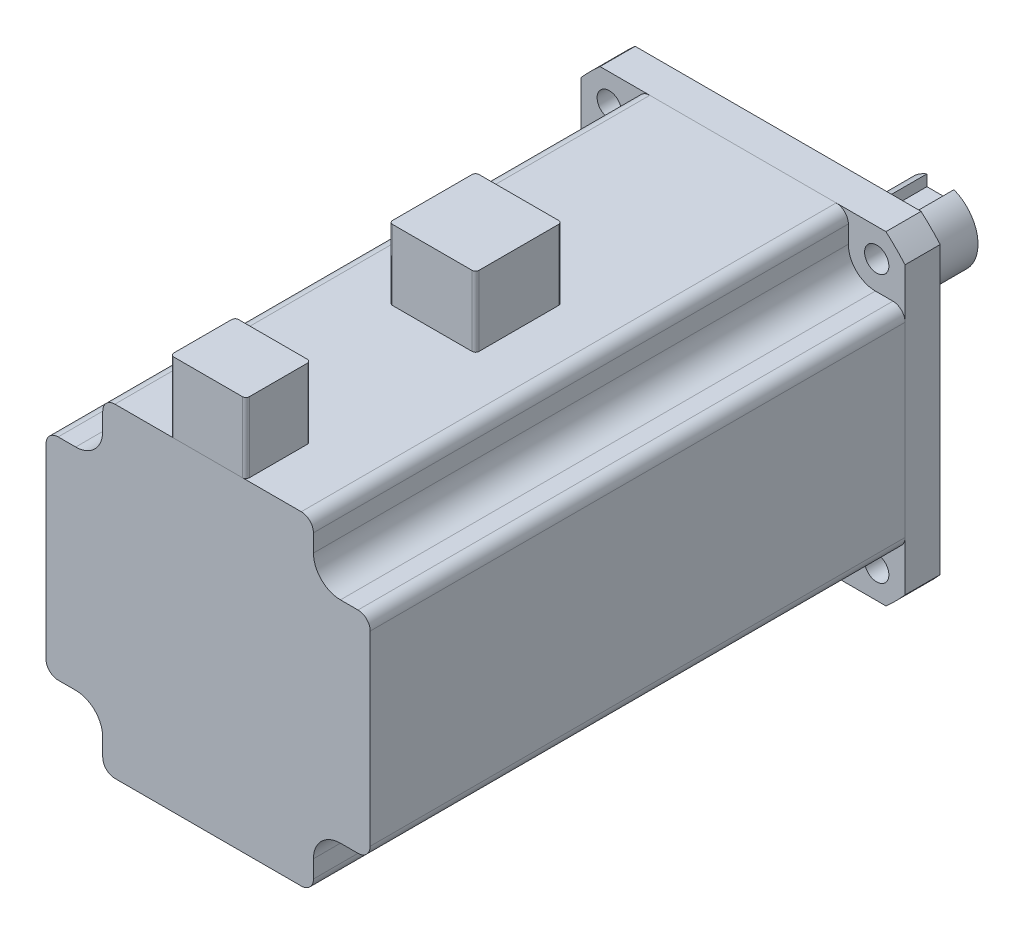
SolidWorks part; units mm, degrees
ref_plane "前视基准面" through (0, 0, 0) normal (0, 0, 1) x (1, 0, 0)
ref_plane "上视基准面" through (0, 0, 0) normal (0, 1, 0) x (1, 0, 0)
ref_plane "右视基准面" through (0, 0, 0) normal (1, 0, 0) x (0, 0, -1)
sketch "草图1" plane through (0, 0, 0) normal (0, 0, 1) x (1, 0, 0)
  line L1 (-59.0644, 2.8149) -> (-111.9794, 2.8149)
  line L2 (-55.5219, -0.7276) -> (-55.5219, -53.6426)
  line L3 (-59.0644, -57.1851) -> (-111.9794, -57.1851)
  line L4 (-115.5219, -0.7276) -> (-115.5219, -53.6426)
  line L5 (-57.2376, 1.0991) -> (-113.8062, -55.4694) construction
  line L6 (-57.2376, -55.4694) -> (-113.8062, 1.0991) construction
  circle A0 centre (-110.2706, -2.4364) radius 2.25
  circle A1 centre (-60.7732, -2.4364) radius 2.25
  circle A2 centre (-60.7732, -51.9339) radius 2.25
  circle A3 centre (-110.2706, -51.9339) radius 2.25
  arc A4 (-115.5219, -53.6426) -> (-111.9794, -57.1851) centre (-85.5219, -27.1851) ccw
  arc A5 (-111.9794, 2.8149) -> (-115.5219, -0.7276) centre (-85.5219, -27.1851) ccw
  arc A6 (-55.5219, -0.7276) -> (-59.0644, 2.8149) centre (-85.5219, -27.1851) ccw
  arc A7 (-59.0644, -57.1851) -> (-55.5219, -53.6426) centre (-85.5219, -27.1851) ccw
  point P0 (-85.5219, -27.1851)
  dimension "D3" = 4.5
  dimension "D4" = 35
  dimension "D6" = 80
  dimension "D5" = 4
extrude "凸台-拉伸1" add sketch "草图1" along normal blind 6.5
sketch "草图2" plane through (0, 0, 0) normal (0, 0, -1) x (-1, 0, 0)
  circle A0 centre (85.5219, -27.1851) radius 25
  dimension "D1" = 50
extrude "凸台-拉伸2" add sketch "草图2" along normal blind 3
sketch "草图3" plane through (0, 0, -3) normal (0, 0, -1) x (-1, 0, 0)
  line L2 (87.9764, -20.6296) -> (87.9764, -22.6851)
  line L3 (87.9764, -22.6851) -> (82.9764, -22.6851)
  line L4 (82.9764, -20.6643) -> (82.9764, -22.6851)
  arc A0 (82.9764, -20.6643) -> (87.9764, -20.6296) centre (85.5219, -27.1851) ccw
  point P3 (85.5219, -20.1851)
  dimension "D1" = 14
  dimension "D2" = 5
  dimension "D3" = 2.5
extrude "凸台-拉伸3" add sketch "草图3" along normal blind 27
sketch "草图4" plane through (0, 0, 6.5) normal (0, 0, 1) x (1, 0, 0)
  line L0 (-115.5219, -0.7276) -> (-115.5219, -53.6426) construction
  line L1 (-68.2762, 2.8149) -> (-102.7676, 2.8149)
  line L2 (-55.5219, -9.9394) -> (-55.5219, -44.4309)
  line L3 (-68.2762, -57.1851) -> (-102.7676, -57.1851)
  line L4 (-115.5219, -9.9394) -> (-115.5219, -44.4309)
  line L7 (-111.9794, -57.1851) -> (-59.0644, -57.1851) construction
  line L8 (-66.0219, 0.5606) -> (-66.0219, -2.6851)
  line L9 (-105.0219, 0.5606) -> (-105.0219, -2.6851)
  line L10 (-113.2676, -7.6851) -> (-110.0219, -7.6851)
  line L11 (-113.2676, -46.6851) -> (-110.0219, -46.6851)
  line L12 (-61.0219, -7.6851) -> (-57.7762, -7.6851)
  line L13 (-105.0219, -51.6851) -> (-105.0219, -54.9309)
  line L15 (-61.0219, -46.6851) -> (-57.7762, -46.6851)
  line L16 (-66.0219, -51.6851) -> (-66.0219, -54.9309)
  arc A0 (-61.0219, -46.6851) -> (-66.0219, -51.6851) centre (-61.0219, -51.6851) ccw
  arc A1 (-61.0219, -7.6851) -> (-66.0219, -2.6851) centre (-61.0219, -2.6851) cw
  arc A2 (-110.0219, -7.6851) -> (-105.0219, -2.6851) centre (-110.0219, -2.6851) ccw
  arc A3 (-105.0219, -51.6851) -> (-110.0219, -46.6851) centre (-110.0219, -51.6851) ccw
  arc A4 (-113.2676, -7.6851) -> (-115.5219, -9.9394) centre (-113.2676, -9.9394) ccw
  arc A5 (-105.0219, 0.5606) -> (-102.7676, 2.8149) centre (-102.7676, 0.5606) cw
  arc A6 (-66.0219, 0.5606) -> (-68.2762, 2.8149) centre (-68.2762, 0.5606) ccw
  arc A7 (-55.5219, -9.9394) -> (-57.7762, -7.6851) centre (-57.7762, -9.9394) ccw
  arc A8 (-55.5219, -44.4309) -> (-57.7762, -46.6851) centre (-57.7762, -44.4309) cw
  arc A9 (-68.2762, -57.1851) -> (-66.0219, -54.9309) centre (-68.2762, -54.9309) ccw
  arc A10 (-102.7676, -57.1851) -> (-105.0219, -54.9309) centre (-102.7676, -54.9309) cw
  arc A11 (-113.2676, -46.6851) -> (-115.5219, -44.4309) centre (-113.2676, -44.4309) cw
  point P0 (-85.5219, -27.1851)
  point P3 (-66.0219, -46.6851)
  dimension "D5" = 5
  dimension "D6" = 2.2543
  dimension "D1" = 10.5
  dimension "D2" = 10.5
  dimension "D3" = 10.5
  dimension "D4" = 10.5
extrude "凸台-拉伸4" add sketch "草图4" along normal blind 99 separate body
sketch "草图5" plane through (0, 2.8149, 0) normal (0, 1, 0) x (1, 0, 0)
  line L0 (-85.5219, -105.5) -> (-85.5219, -6.5) construction
  line L1 (-68.2762, -105.5) -> (-102.7676, -105.5) construction
  line L2 (-68.2762, -6.5) -> (-102.7676, -6.5) construction
  line L4 (-79.1604, -93.5) -> (-91.8834, -93.5)
  line L5 (-78.5219, -94.1385) -> (-78.5219, -104.8615)
  line L6 (-79.1604, -105.5) -> (-91.8834, -105.5)
  line L7 (-92.5219, -94.1385) -> (-92.5219, -104.8615)
  line L8 (-78.5219, -93.5) -> (-92.5219, -105.5) construction
  line L9 (-78.5219, -105.5) -> (-92.5219, -93.5) construction
  line L10 (-78.1604, -48) -> (-92.8834, -48)
  line L11 (-77.5219, -48.6385) -> (-77.5219, -63.3615)
  line L12 (-78.1604, -64) -> (-92.8834, -64)
  line L13 (-93.5219, -48.6385) -> (-93.5219, -63.3615)
  line L14 (-77.5219, -48) -> (-93.5219, -64) construction
  line L15 (-77.5219, -64) -> (-93.5219, -48) construction
  arc A0 (-91.8834, -105.5) -> (-92.5219, -104.8615) centre (-91.8834, -104.8615) cw
  arc A1 (-78.5219, -104.8615) -> (-79.1604, -105.5) centre (-79.1604, -104.8615) cw
  arc A2 (-79.1604, -93.5) -> (-78.5219, -94.1385) centre (-79.1604, -94.1385) cw
  arc A3 (-91.8834, -93.5) -> (-92.5219, -94.1385) centre (-91.8834, -94.1385) ccw
  arc A4 (-92.8834, -64) -> (-93.5219, -63.3615) centre (-92.8834, -63.3615) cw
  arc A5 (-77.5219, -63.3615) -> (-78.1604, -64) centre (-78.1604, -63.3615) cw
  arc A6 (-78.1604, -48) -> (-77.5219, -48.6385) centre (-78.1604, -48.6385) cw
  arc A7 (-92.8834, -48) -> (-93.5219, -48.6385) centre (-92.8834, -48.6385) ccw
  point P6 (-85.5219, -99.5)
  point P11 (-85.5219, -56)
  dimension "D5" = 0.6385
  dimension "D1" = 16
  dimension "D2" = 16
  dimension "D3" = 14
  dimension "D4" = 12
extrude "凸台-拉伸5" add sketch "草图5" along normal blind 13 separate body
